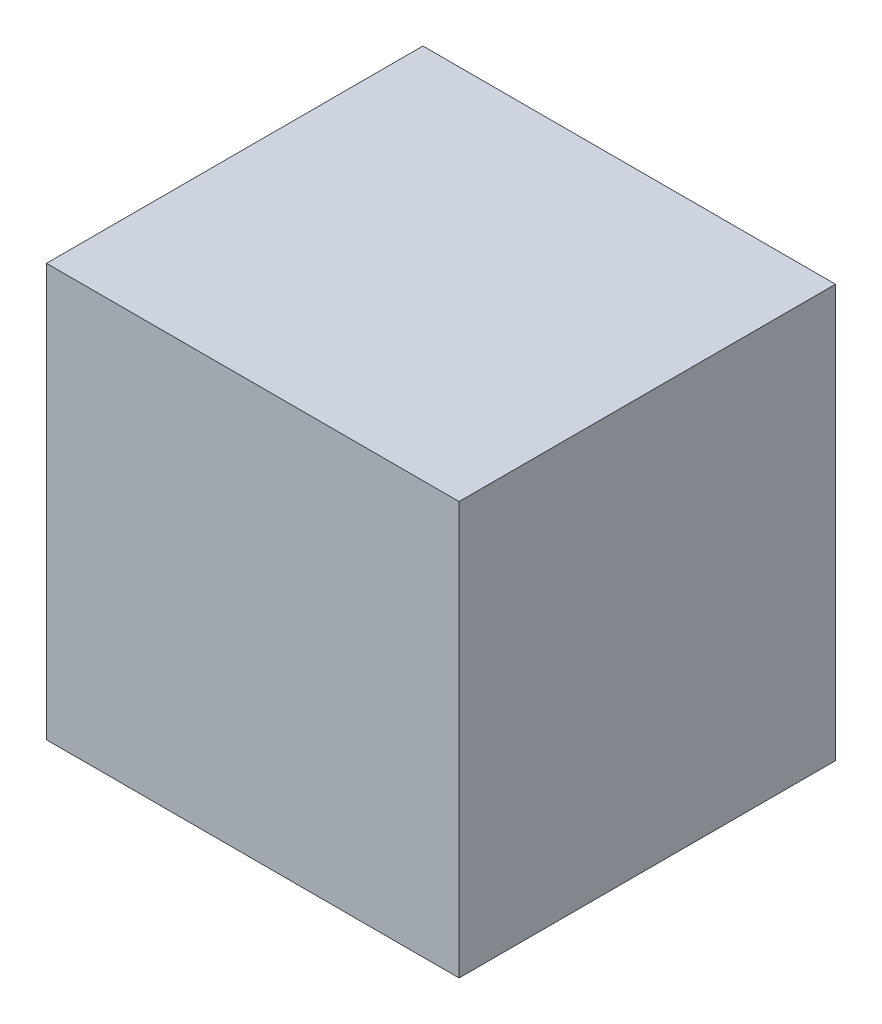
SolidWorks part; units mm, degrees
ref_plane "Front Plane" through (0, 0, 0) normal (0, 0, 1) x (1, 0, 0)
ref_plane "Top Plane" through (0, 0, 0) normal (0, 1, 0) x (1, 0, 0)
ref_plane "Right Plane" through (0, 0, 0) normal (1, 0, 0) x (0, 0, -1)
sketch "Sketch1" plane through (0, 0, 0) normal (0, 0, 1) x (1, 0, 0)
  line L1 (-28.5, -28.5) -> (28.5, -28.5)
  line L2 (-28.5, -28.5) -> (-28.5, 28.5)
  line L3 (-28.5, 28.5) -> (28.5, 28.5)
  line L4 (28.5, -28.5) -> (28.5, 28.5)
  line L5 (-28.5, -28.5) -> (28.5, 28.5) construction
  line L6 (-28.5, 28.5) -> (28.5, -28.5) construction
  point P0 (0, 0)
  dimension "D1" = 57
  dimension "D2" = 57
extrude "Boss-Extrude1" add sketch "Sketch1" along normal mid plane 52
